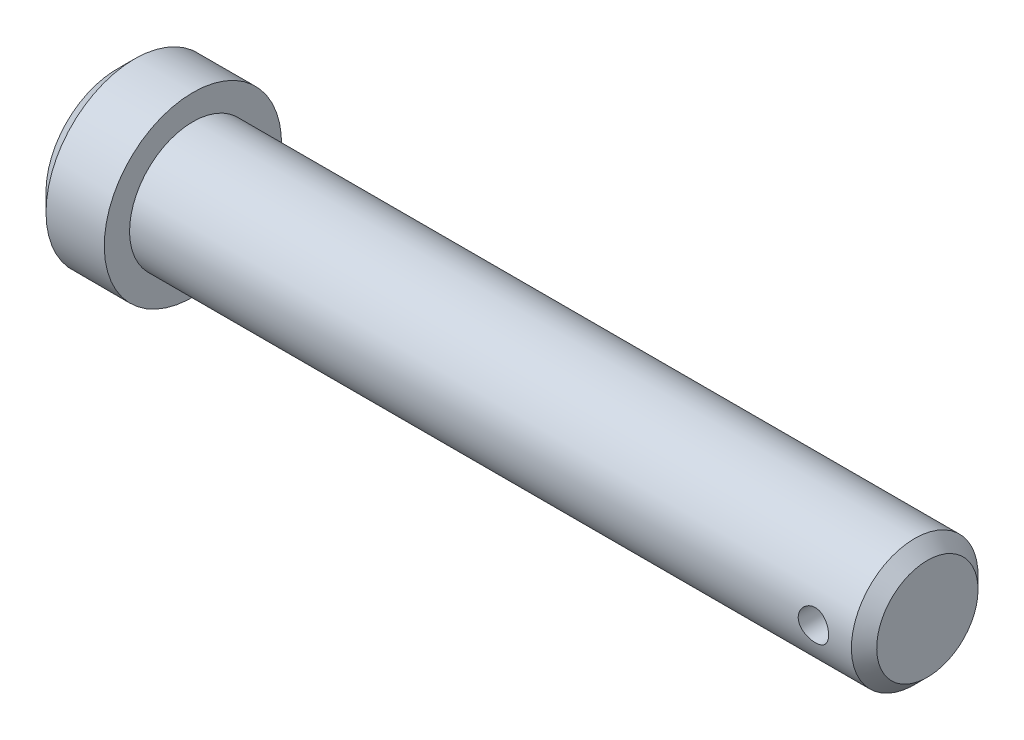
SolidWorks part; units mm, degrees
ref_plane "Спереди" through (0, 0, 0) normal (0, 0, 1) x (1, 0, 0)
ref_plane "Сверху" through (0, 0, 0) normal (0, 1, 0) x (1, 0, 0)
ref_plane "Справа" through (0, 0, 0) normal (1, 0, 0) x (0, 0, -1)
sketch "Эскиз1" plane through (0, 0, 0) normal (0, 0, 1) x (1, 0, 0)
  line L0 (0, 0) -> (0, 3.5)
  line L1 (0, 3.5) -> (3, 3.5)
  line L2 (3, 3.5) -> (3, 2.5)
  line L3 (3, 2.5) -> (32, 2.5)
  line L4 (32, 2.5) -> (32, 0)
  line L5 (32, 0) -> (0, 0)
  dimension "D1" = 3.5
  dimension "D2" = 3
  dimension "D3" = 32
  dimension "D4" = 2.5
revolve "Повернуть1" add sketch "Эскиз1" angle 360 about L5
sketch "Эскиз2" plane through (0, 0, 0) normal (0, 0, 1) x (1, 0, 0)
  line L0 (0, 0) -> (32.7321, 0) construction
  line L1 (3, -3.5) -> (3, 3.5) construction
  circle A0 centre (30, 0) radius 0.6
  dimension "D1" = 1.2
  dimension "D2" = 27
extrude "Вырез-Вытянуть1" cut sketch "Эскиз2" against normal through all both and the other way through all
chamfer "Фаска1" distance 0.7 angle 45 1 edges at (0, 3.5, 0)
chamfer "Фаска2" distance 0.5 angle 45 1 edges at (32, 2.5, 0)
